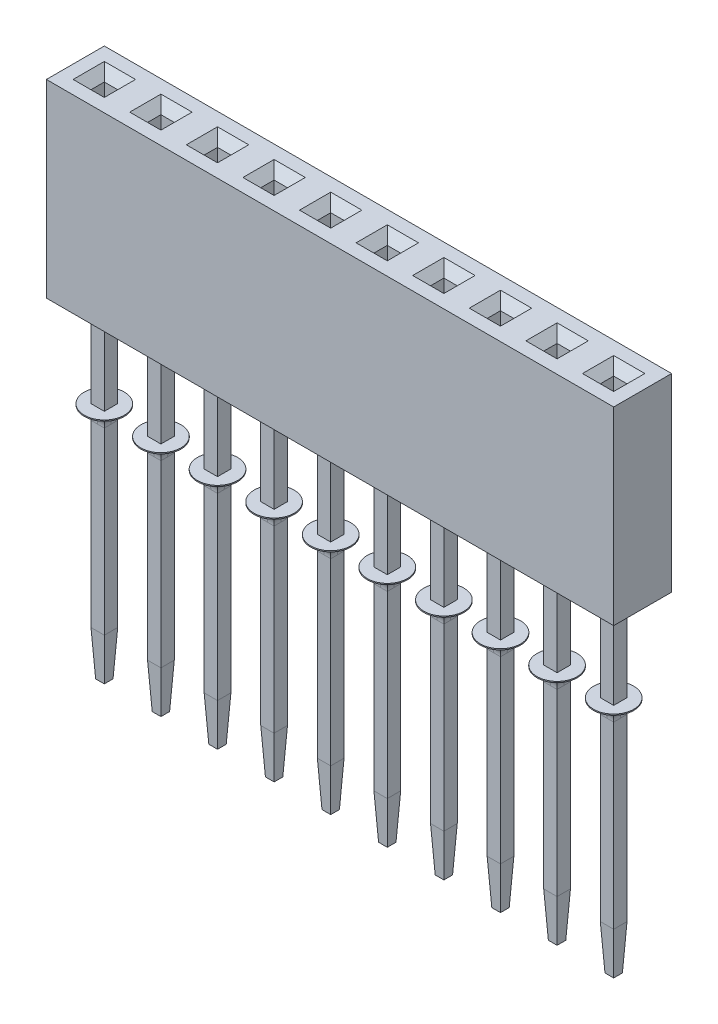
SolidWorks part; units mm, degrees
ref_plane "Plan de face" through (0, 0, 0) normal (0, 0, 1) x (1, 0, 0)
ref_plane "Plan de dessus" through (0, 0, 0) normal (0, 1, 0) x (1, 0, 0)
ref_plane "Plan de droite" through (0, 0, 0) normal (1, 0, 0) x (0, 0, -1)
sketch "Esquisse1" plane through (0, 0, 0) normal (0, 1, 0) x (1, 0, 0)
  line L1 (-1.3, -1.3) -> (1.3, -1.3)
  line L2 (-1.3, -1.3) -> (-1.3, 1.3)
  line L3 (-1.3, 1.3) -> (1.3, 1.3)
  line L4 (1.3, -1.3) -> (1.3, 1.3)
  line L5 (-1.3, -1.3) -> (1.3, 1.3) construction
  line L6 (-1.3, 1.3) -> (1.3, -1.3) construction
  line L7 (-0.3, -0.3) -> (0.3, -0.3)
  line L8 (-0.3, -0.3) -> (-0.3, 0.3)
  line L9 (-0.3, 0.3) -> (0.3, 0.3)
  line L10 (0.3, -0.3) -> (0.3, 0.3)
  line L11 (-0.3, -0.3) -> (0.3, 0.3) construction
  line L12 (-0.3, 0.3) -> (0.3, -0.3) construction
  point P0 (0, 0)
  point P5 (0, 0)
  dimension "D1" = 2.6
  dimension "D2" = 0.6
extrude "Boss.-Extru.1" add sketch "Esquisse1" along normal blind 8.5
chamfer "Chanfrein1" distance 0.4 angle 45 4 edges at (0.3, 8.5, 0) (0, 8.5, 0.3) (-0.3, 8.5, 0) (0, 8.5, -0.3)
sketch "Esquisse2" plane through (0, 0, 0) normal (0, -1, 0) x (1, 0, 0)
  line L1 (-0.3, -0.3) -> (0.3, -0.3)
  line L2 (-0.3, -0.3) -> (-0.3, 0.3)
  line L3 (-0.3, 0.3) -> (0.3, 0.3)
  line L4 (0.3, -0.3) -> (0.3, 0.3)
extrude "Boss.-Extru.2" add sketch "Esquisse2" along normal blind 14.8 separate body
chamfer "Chanfrein2" distance 2 angle 3 4 edges at (0, -14.8, 0.3) (0.3, -14.8, 0) (0, -14.8, -0.3) (-0.3, -14.8, 0)
ref_plane "Plan1" through (0, -4.1, 0) normal (0, -1, 0) x (-1, 0, 0)
sketch "Esquisse4" plane through (0, -4.1, 0) normal (0, -1, 0) x (-1, 0, 0)
  circle A0 centre (0, 0) radius 0.9
extrude "Boss.-Extru.3" add sketch "Esquisse4" along normal blind 0.05
fillet "Congé1" radius 0.6 4 edges at (0, -4.15, -0.3) (0.3, -4.15, 0) (0, -4.15, 0.3) (-0.3, -4.15, 0)
pattern_linear "Répétition linéaire4" count 10 spacing 2.54 along (1, 0, 0) of "Boss.-Extru.1", "Chanfrein1"
pattern_linear "Répétition linéaire6" count 10 spacing 2.54
